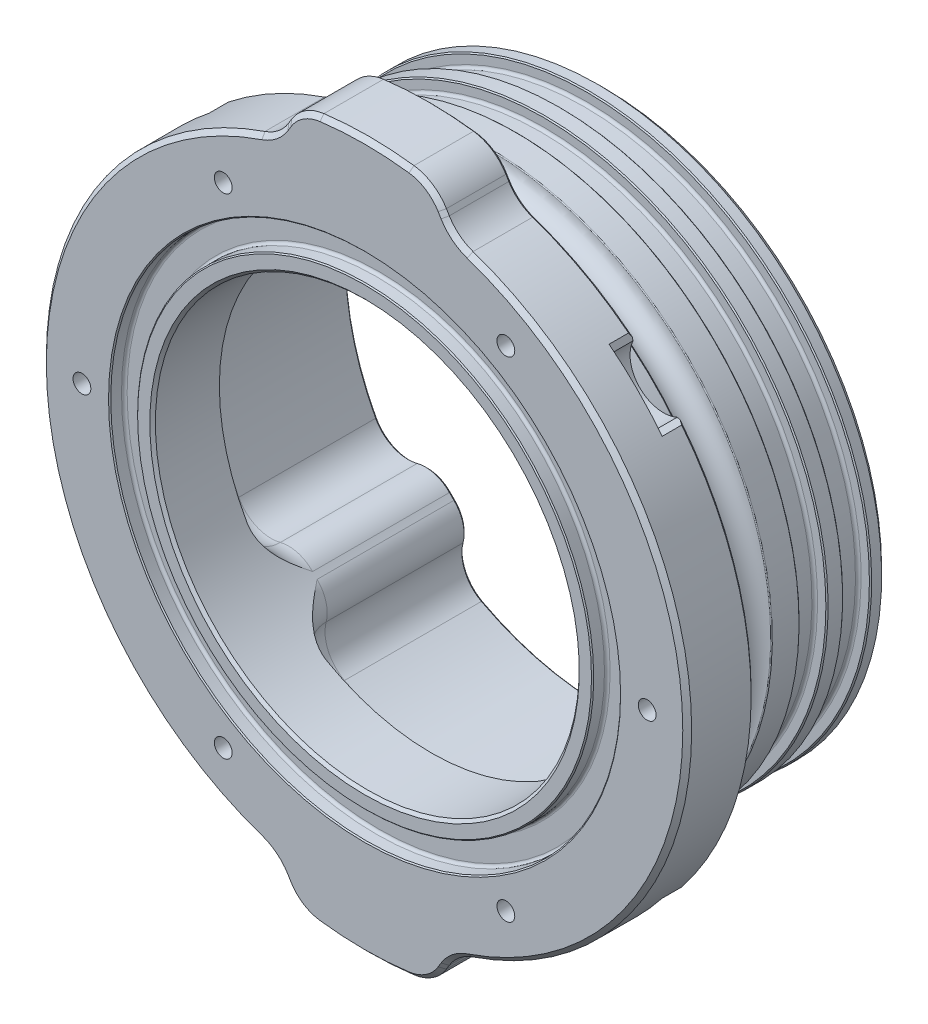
SolidWorks part; units mm, degrees
other "<WTE2-M-LOCKING-FLANGE-R1>-<Bore Chamfer>"
ref_plane "Front Plane" through (0, 0, 0) normal (0, 0, 1) x (1, 0, 0)
ref_plane "Top Plane" through (0, 0, 0) normal (0, 1, 0) x (1, 0, 0)
ref_plane "Right Plane" through (0, 0, 0) normal (1, 0, 0) x (0, 0, -1)
inserted part "WTE2-M-LOCKING-FLANGE-R1"
